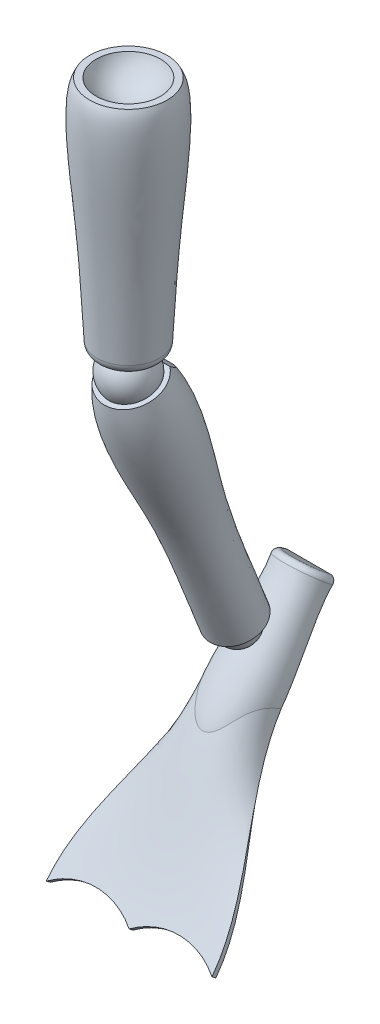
SolidWorks part; units mm, degrees
ref_plane "Plano frontal" through (0, 0, 0) normal (0, 0, 1) x (1, 0, 0)
ref_plane "Plano superior" through (0, 0, 0) normal (0, 1, 0) x (1, 0, 0)
ref_plane "Plano direito" through (0, 0, 0) normal (1, 0, 0) x (0, 0, -1)
imported_body "SW3dPS-manikin_Theigh-1-solid1"
imported_body "SW3dPS-manikin_Shin-1-solid1"
imported_body "SW3dPS-manikin_Foot-1-solid1"
combine bodies "Combinar1" operation type add bodies to combine 101 102 103
scale "Escala1" scale about centroid uniform scaling yes scale factor 6
